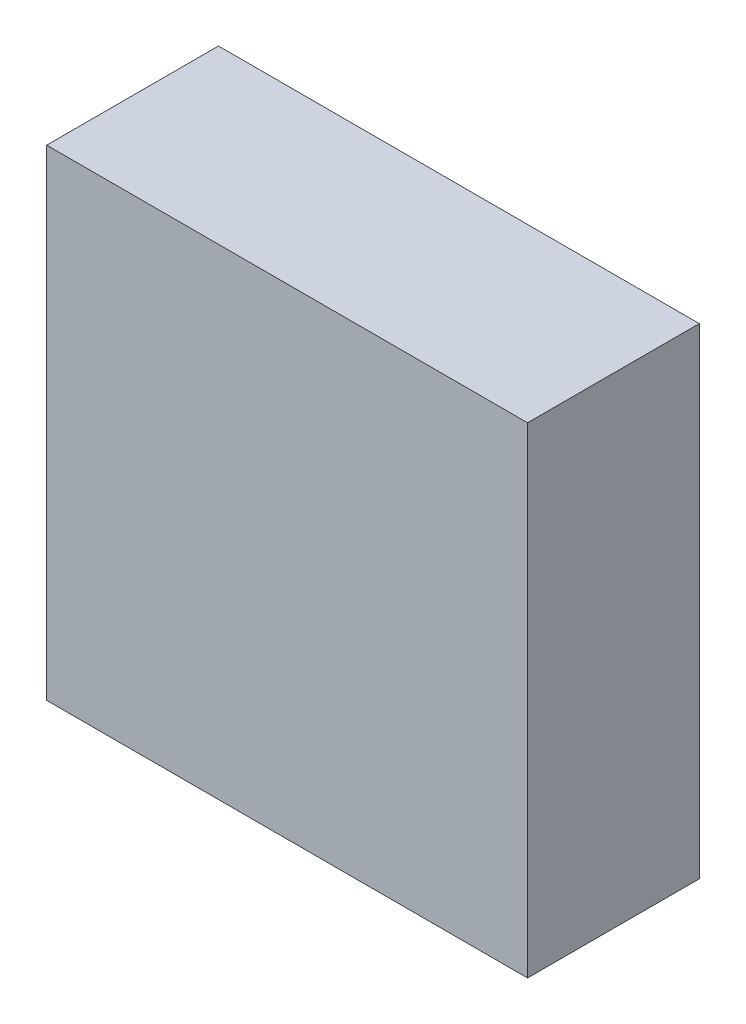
SolidWorks part; units mm, degrees
ref_plane "Plan de face" through (0, 0, 0) normal (0, 0, 1) x (1, 0, 0)
ref_plane "Plan de dessus" through (0, 0, 0) normal (0, 1, 0) x (1, 0, 0)
ref_plane "Plan de droite" through (0, 0, 0) normal (1, 0, 0) x (0, 0, -1)
sketch "Esquisse1" plane through (0, 0, 0) normal (0, 0, 1) x (1, 0, 0)
  line L1 (-35, 35) -> (35, 35)
  line L2 (-35, 35) -> (-35, -35)
  line L3 (-35, -35) -> (35, -35)
  line L4 (35, 35) -> (35, -35)
  dimension "D1" = 70
  dimension "D2" = 70
  dimension "D3" = 35
  dimension "D4" = 35
extrude "Boss.-Extru.1" add sketch "Esquisse1" along normal blind 25
